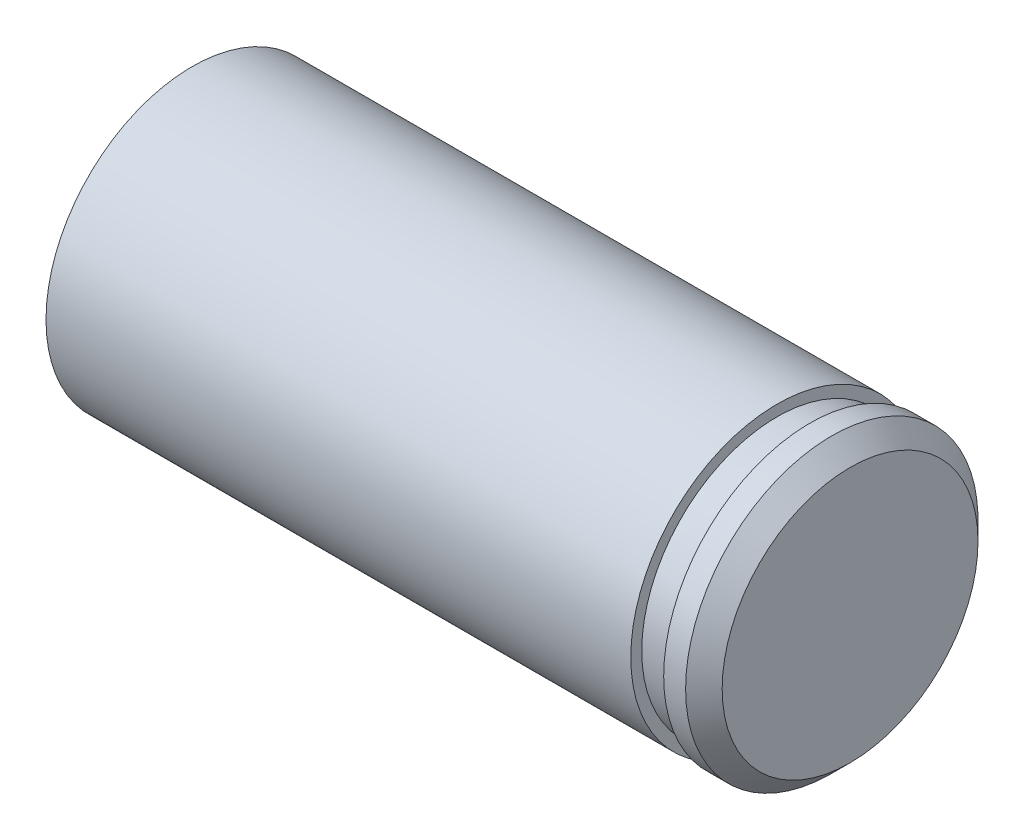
SolidWorks part; units mm, degrees
ref_plane "Face" through (0, 0, 0) normal (0, 0, 1) x (1, 0, 0)
ref_plane "Dessus" through (0, 0, 0) normal (0, 1, 0) x (1, 0, 0)
ref_plane "Droite" through (0, 0, 0) normal (1, 0, 0) x (0, 0, -1)
sketch "Esquisse1" plane through (0, 0, 0) normal (0, 0, 1) x (1, 0, 0)
  line L0 (0, 0) -> (0, 4)
  line L1 (0, 4) -> (16, 4)
  line L2 (16, 4) -> (16, 3.7)
  line L3 (16, 3.7) -> (16.9, 3.7)
  line L4 (16.9, 3.7) -> (16.9, 4)
  line L5 (16.9, 4) -> (17.5, 4)
  line L6 (18, 3.5) -> (18, 0)
  line L7 (18, 0) -> (0, 0)
  line L8 (-21.2463, 0) -> (115.9174, 0) construction
  line L9 (17.5, 4) -> (18, 3.5)
  point P7 (18, 4)
  dimension "D1" = 4
  dimension "D2" = 16
  dimension "D3" = 0.9
  dimension "D4" = 3.7
  dimension "D5" = 18
  dimension "D6" = 0.5
  dimension "D7" = 45
revolve "Révolution1" add sketch "Esquisse1" angle 360 about L8
hole_wizard "Trou taraudé M5x0.81" positions "Esquisse3" profile "Esquisse2" tap size "M5x0.8" standard "ISO"
sketch "Esquisse3" plane through (0, 0, 0) normal (-1, 0, 0) x (0, 0, 1)
  point P0 (0, 0)
sketch "Esquisse2" plane through (0, 0, 0) normal (0, 1, 0) x (0, 0, 1)
  line L0 (0, 0) -> (0, 13.2124)
  line L1 (0, 13.2124) -> (2.1, 12)
  line L2 (2.1, 12) -> (2.1, 0)
  line L5 (2.1, 0) -> (0, 0)
  line L10 (0, 13.2124) -> (-2.1, 12) construction
  line L11 (0, -6.35) -> (0, 107.95) construction
  dimension "Diamètre du trou pour taraudage" = 4.2
  dimension "Profondeur du trou pour taraudage" = 12
  dimension "Angle de pointe" = 120
